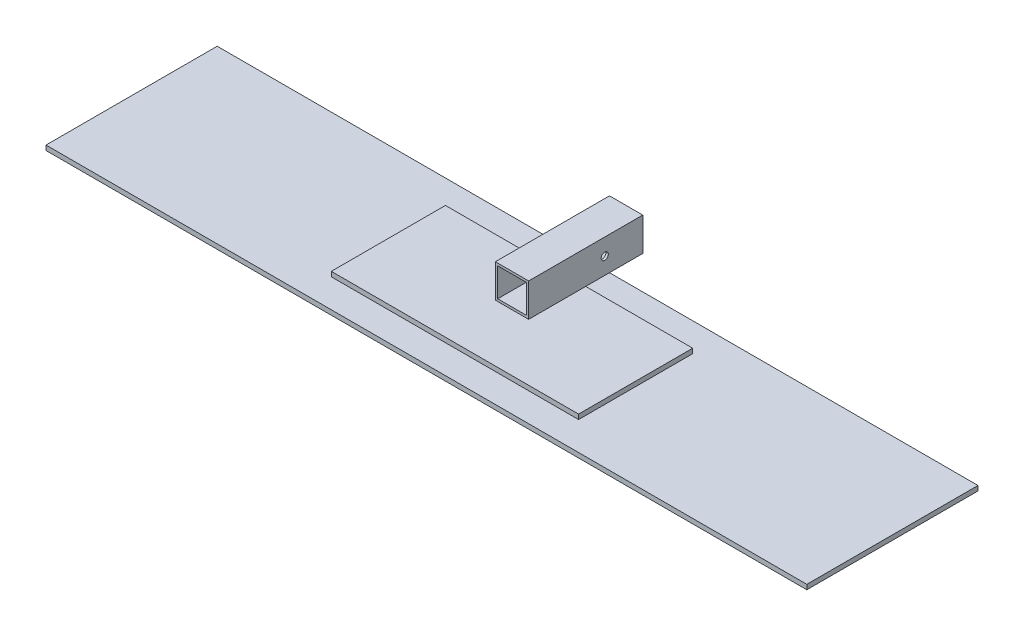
SolidWorks part; units mm, degrees
ref_plane "Front Plane" through (0, 0, 0) normal (0, 0, 1) x (1, 0, 0)
ref_plane "Top Plane" through (0, 0, 0) normal (0, 1, 0) x (1, 0, 0)
ref_plane "Right Plane" through (0, 0, 0) normal (1, 0, 0) x (0, 0, -1)
sketch "Sketch1" plane through (0, 0, 0) normal (0, 1, 0) x (1, 0, 0)
  line L1 (-508, -114.3) -> (508, -114.3)
  line L2 (-508, -114.3) -> (-508, 114.3)
  line L3 (-508, 114.3) -> (508, 114.3)
  line L4 (508, -114.3) -> (508, 114.3)
  line L5 (-508, -114.3) -> (508, 114.3) construction
  line L6 (-508, 114.3) -> (508, -114.3) construction
  point P0 (0, 0)
  dimension "d1" = 228.6
  dimension "D2" = 1016
extrude "Boss-Extrude1" add sketch "Sketch1" along normal blind 6.35
sketch "small panel" plane through (0, 6.35, 0) normal (0, 1, 0) x (1, 0, 0)
  line L1 (165.1, -76.2) -> (-165.1, -76.2)
  line L2 (165.1, -76.2) -> (165.1, 76.2)
  line L3 (165.1, 76.2) -> (-165.1, 76.2)
  line L4 (-165.1, -76.2) -> (-165.1, 76.2)
  line L5 (165.1, -76.2) -> (-165.1, 76.2) construction
  line L6 (165.1, 76.2) -> (-165.1, -76.2) construction
  point P0 (0, 0)
  dimension "D1" = 330.2
  dimension "D2" = 152.4
extrude "Boss-Extrude2" add sketch "small panel" along normal blind 6.35
sketch "reference sketch" plane through (0, 12.7, 0) normal (0, 1, 0) x (1, 0, 0)
  line L0 (165.1, -76.2) -> (165.1, 76.2) construction
  line L1 (-165.1, 76.2) -> (-165.1, -76.2) construction
  line L2 (165.1, -76.2) -> (165.1, 76.2)
  line L3 (-165.1, 76.2) -> (-165.1, -76.2)
  line L4 (-165.1, 0) -> (165.1, 0) construction
sketch "arm attachment sleeve" plane through (0, 0, 0) normal (0, 0, 1) x (1, 0, 0)
  line L0 (-165.1, 12.7) -> (165.1, 12.7) construction
  line L1 (22.225, 12.7) -> (-22.225, 12.7)
  line L2 (22.225, 12.7) -> (22.225, 57.15)
  line L3 (22.225, 57.15) -> (-22.225, 57.15)
  line L4 (-22.225, 12.7) -> (-22.225, 57.15)
  line L5 (0, -26.352) -> (0, 26.352) construction
  line L8 (-19.05, 15.875) -> (19.05, 15.875)
  line L9 (-19.05, 15.875) -> (-19.05, 53.975)
  line L10 (-19.05, 53.975) -> (19.05, 53.975)
  line L11 (19.05, 15.875) -> (19.05, 53.975)
  point P7 (0, 12.7)
  dimension "D1" = 44.45
  dimension "D2" = 44.45
  dimension "D3" = 3.175
  dimension "D4" = 3.175
  dimension "D5" = 3.175
  dimension "D6" = 3.175
extrude "Boss-Extrude3" add sketch "arm attachment sleeve" against normal blind 152.4
sketch "Sketch7" plane through (-22.225, 0, 0) normal (-1, 0, 0) x (0, 0, 1)
  line L0 (0, 57.15) -> (0, 12.7) construction
  circle A0 centre (-101.6, 34.925) radius 4.7625
  point P2 (0, 34.925)
  dimension "D1" = 9.525
  dimension "D2" = 101.6
extrude "Cut-Extrude1" cut sketch "Sketch7" against normal through all
equation "\"back_plate_height\"= \"D2@small panel\""
